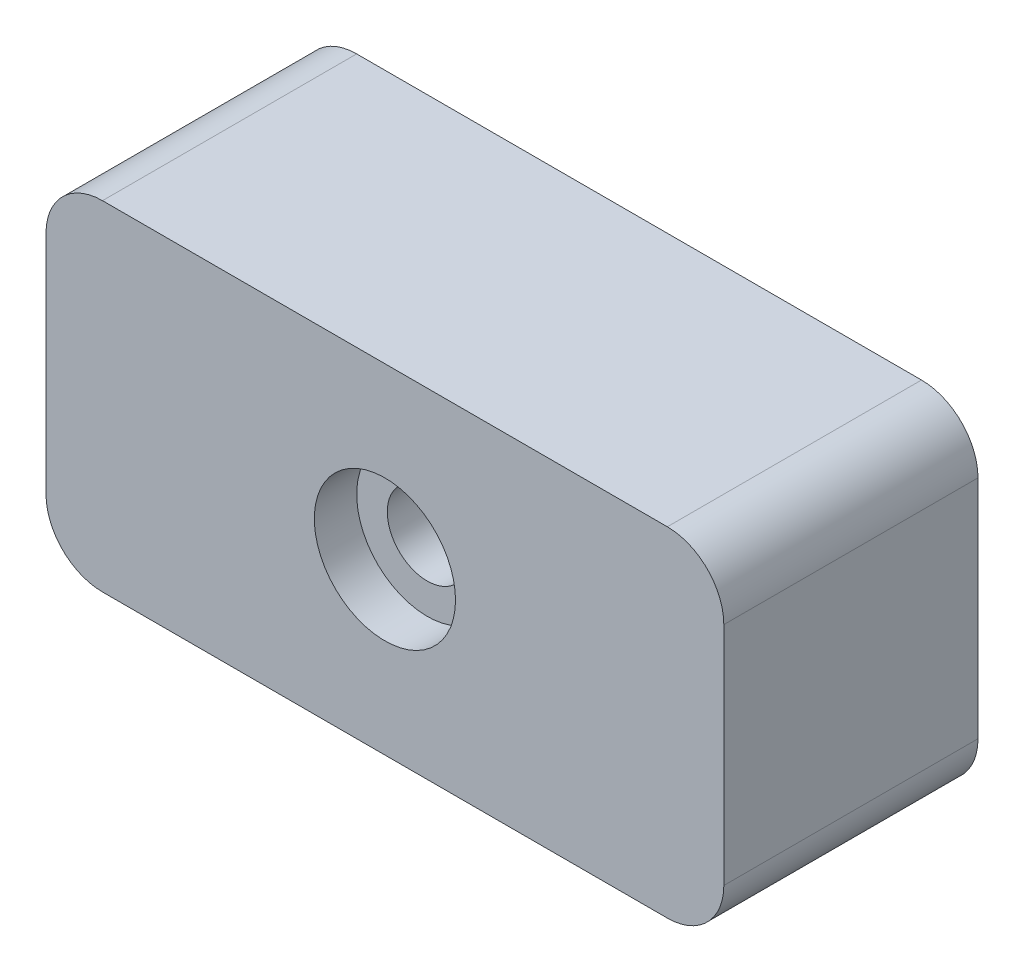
SolidWorks part; units mm, degrees
ref_plane "Front Plane" through (0, 0, 0) normal (0, 0, 1) x (1, 0, 0)
ref_plane "Top Plane" through (0, 0, 0) normal (0, 1, 0) x (1, 0, 0)
ref_plane "Right Plane" through (0, 0, 0) normal (1, 0, 0) x (0, 0, -1)
sketch "Sketch2" plane through (0, 0, 0) normal (0, 0, 1) x (1, 0, 0)
  line L1 (-19.05, -9.525) -> (19.05, -9.525)
  line L2 (-19.05, -9.525) -> (-19.05, 9.525)
  line L3 (-19.05, 9.525) -> (19.05, 9.525)
  line L4 (19.05, -9.525) -> (19.05, 9.525)
  line L5 (-19.05, -9.525) -> (19.05, 9.525) construction
  line L6 (-19.05, 9.525) -> (19.05, -9.525) construction
  point P0 (0, 0)
  dimension "D1" = 38.1
  dimension "D2" = 19.05
extrude "Boss-Extrude2" add sketch "Sketch2" along normal blind 14.2875
hole_wizard "CBORE for #8 Socket Head Cap Screw1" positions "Sketch4" profile "Sketch3" counterbore size "#8" standard "Ansi Inch"
sketch "Sketch4" plane through (0, 0, 14.2875) normal (0, 0, 1) x (1, 0, 0)
  point P0 (0, 0)
sketch "Sketch3" plane through (0, 0, 14.2875) normal (1, 0, 0) x (0, -1, 0)
  line L0 (0, 0) -> (0, 14.2875)
  line L1 (0, 14.2875) -> (2.2479, 14.2875)
  line L3 (2.2479, 14.2875) -> (2.2479, 2.3812)
  line L4 (2.2479, 2.3812) -> (3.9688, 2.3812)
  line L5 (3.9688, 2.3812) -> (3.9687, 0)
  line L7 (3.9687, 0) -> (0, 0)
  line L11 (0, -6.35) -> (0, 107.95) construction
  dimension "Thru Hole Dia." = 4.4958
  dimension "Thru Hole Depth" = 14.2875
  dimension "C'Bore Dia." = 7.9375
  dimension "C'Bore Depth" = 2.3812
fillet "Fillet1" radius 3.175 4 edges at (19.05, -9.525, 7.1437) (-19.05, -9.525, 7.1437) (19.05, 9.525, 7.1437) (-19.05, 9.525, 7.1437)
